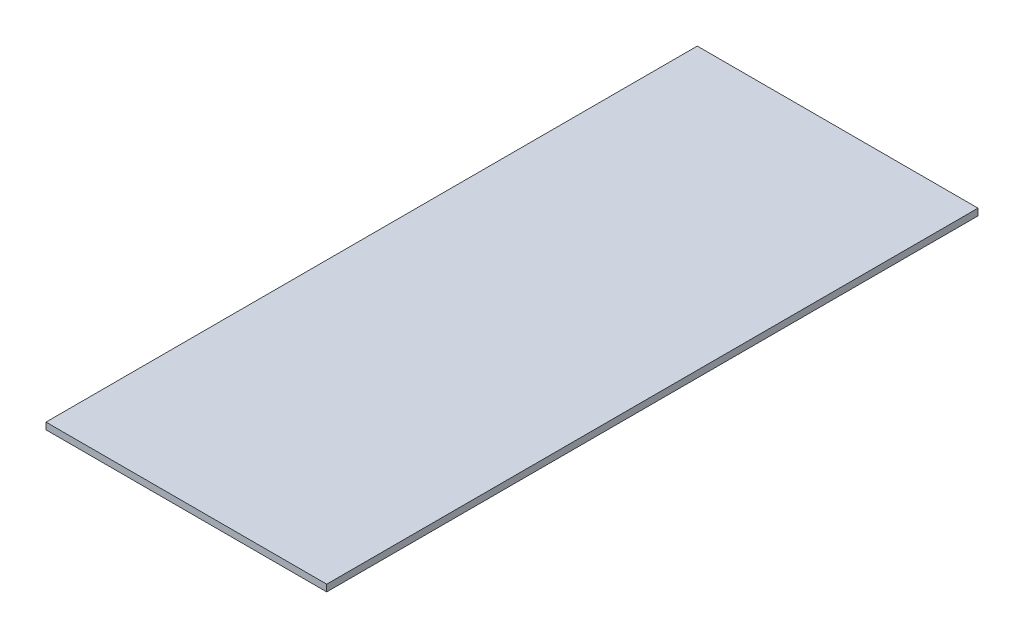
SolidWorks part; units mm, degrees
ref_plane "Plano frontal" through (0, 0, 0) normal (0, 0, 1) x (1, 0, 0)
ref_plane "Plano superior" through (0, 0, 0) normal (0, 1, 0) x (1, 0, 0)
ref_plane "Plano direito" through (0, 0, 0) normal (1, 0, 0) x (0, 0, -1)
sketch "Esboço1" plane through (0, 0, 0) normal (0, 1, 0) x (1, 0, 0)
  line L1 (0, 0) -> (250, 0)
  line L2 (0, 0) -> (0, -475)
  line L3 (0, -475) -> (250, -475)
  line L4 (250, 0) -> (250, -475)
extrude "Ressalto-extrusão1" add sketch "Esboço1" along normal blind 6
sketch "Esboço2" plane through (0, 0, 0) normal (0, 0, -1) x (-1, 0, 0)
  line L1 (-250, 6) -> (0, 6)
  line L2 (-250, 6) -> (-250, 0)
  line L3 (-250, 0) -> (0, 0)
  line L4 (0, 6) -> (0, 0)
extrude "Ressalto-extrusão2" add sketch "Esboço2" along normal blind 25
sketch "Esboço3" plane through (0, 0, -25) normal (0, 0, -1) x (-1, 0, 0)
  line L1 (-250, 6) -> (0, 6)
  line L2 (-250, 6) -> (-250, 0)
  line L3 (-250, 0) -> (0, 0)
  line L4 (0, 6) -> (0, 0)
extrude "Ressalto-extrusão4" add sketch "Esboço3" along normal blind 80
